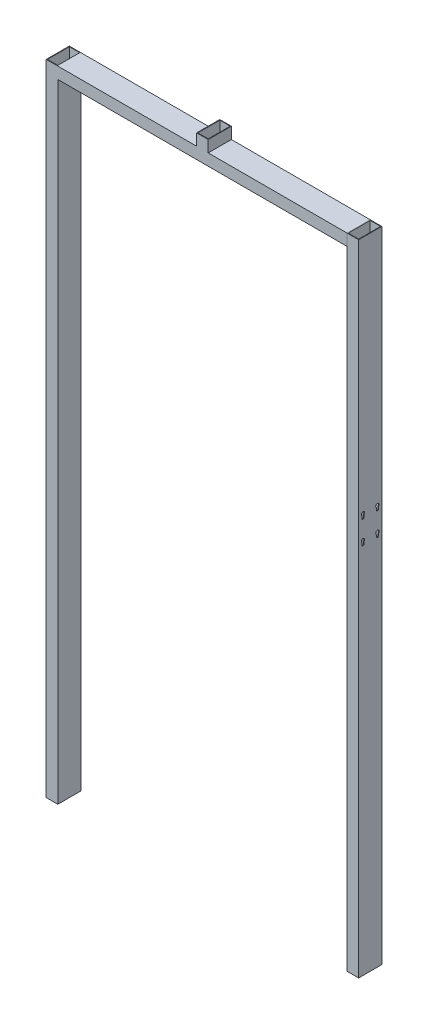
SolidWorks part; units mm, degrees
ref_plane "Plan de face" through (0, 0, 0) normal (0, 0, 1) x (1, 0, 0)
ref_plane "Plan de dessus" through (0, 0, 0) normal (0, 1, 0) x (1, 0, 0)
ref_plane "Plan de droite" through (0, 0, 0) normal (1, 0, 0) x (0, 0, -1)
sketch "Esquisse1" plane through (0, 0, 0) normal (0, 1, 0) x (1, 0, 0)
  line L0 (0, 59.5223) -> (0, -72.028) construction
  line L1 (500, 40) -> (500, -40)
  line L2 (-538, 38) -> (-538, -38)
  line L3 (-538, -38) -> (-502, -38)
  line L4 (-502, 38) -> (-502, -38)
  line L5 (-538, 38) -> (-502, 38)
  line L6 (540, -40) -> (500, -40)
  line L7 (540, 40) -> (540, -40)
  line L8 (540, 40) -> (500, 40)
  line L9 (538, 38) -> (502, 38)
  line L10 (502, 38) -> (502, -38)
  line L11 (538, -38) -> (502, -38)
  line L12 (538, 38) -> (538, -38)
  line L14 (-540, 40) -> (-500, 40)
  line L15 (-540, 40) -> (-540, -40)
  line L16 (-540, -40) -> (-500, -40)
  line L17 (-500, 40) -> (-500, -40)
  dimension "D2" = 40
  dimension "D3" = 2
  dimension "D4" = 40
  dimension "D9" = 80
  dimension "D12" = 500
extrude "Extrusion1" add sketch "Esquisse1" along normal blind 2210
sketch "Esquisse2" plane through (-500, 0, 0) normal (1, 0, 0) x (0, 0, -1)
  line L1 (-40, 2210) -> (40, 2210)
  line L2 (-40, 2210) -> (-40, 2170)
  line L3 (-40, 2170) -> (40, 2170)
  line L4 (40, 2210) -> (40, 2170)
  line L6 (-38, 2208) -> (38, 2208)
  line L7 (-38, 2208) -> (-38, 2172)
  line L8 (-38, 2172) -> (38, 2172)
  line L9 (38, 2208) -> (38, 2172)
  dimension "D1" = 40
  dimension "D2" = 36
  dimension "D3" = 2
  dimension "D4" = 2
  dimension "D5" = 76
  dimension "D6" = 40
extrude "Extrusion2" add sketch "Esquisse2" along normal up to next
sketch "Esquisse3" plane through (0, 2210, 0) normal (0, 1, 0) x (1, 0, 0)
  line L0 (500, 40) -> (-540, 40) construction
  line L1 (-20, 40) -> (20, 40)
  line L2 (-20, 40) -> (-20, -40)
  line L3 (-20, -40) -> (20, -40)
  line L4 (20, 40) -> (20, -40)
  line L5 (-540, -40) -> (500, -40) construction
  line L6 (-18, 38) -> (18, 38)
  line L7 (18, 38) -> (18, -38)
  line L8 (-18, -38) -> (18, -38)
  line L9 (-18, 38) -> (-18, -38)
  dimension "D1" = 40
  dimension "D2" = 20
  dimension "D3" = 2
extrude "Extrusion3" add sketch "Esquisse3" along normal blind 40
sketch "Esquisse7" plane through (-540, 0, 0) normal (-1, 0, 0) x (0, 0, 1)
  line L0 (-40, 2210) -> (-40, 0) construction
  line L1 (-21, 1370) -> (-21, 1377.5279)
  line L2 (-29, 1370) -> (-29, 1377.5279)
  line L3 (40, 2170) -> (-40, 2170) construction
  line L4 (21, 1370) -> (21, 1377.5279)
  line L5 (29, 1370) -> (29, 1377.5279)
  line L6 (-29, 1290) -> (-29, 1297.5279)
  line L7 (-21, 1290) -> (-21, 1297.5279)
  line L8 (21, 1290) -> (21, 1297.5279)
  line L9 (29, 1290) -> (29, 1297.5279)
  arc A0 (-21, 1377.5279) -> (-29, 1377.5279) centre (-25, 1382) ccw
  arc A1 (-29, 1370) -> (-21, 1370) centre (-25, 1370) ccw
  arc A2 (29, 1377.5279) -> (21, 1377.5279) centre (25, 1382) ccw
  arc A3 (21, 1370) -> (29, 1370) centre (25, 1370) ccw
  arc A4 (-21, 1297.5279) -> (-29, 1297.5279) centre (-25, 1302) ccw
  arc A5 (-29, 1290) -> (-21, 1290) centre (-25, 1290) ccw
  arc A6 (29, 1297.5279) -> (21, 1297.5279) centre (25, 1302) ccw
  arc A7 (21, 1290) -> (29, 1290) centre (25, 1290) ccw
  dimension "D2" = 15
  dimension "D3" = 12
  dimension "D4" = 8
  dimension "D5" = 12
  dimension "D6" = 800
  dimension "D1" = 15
extrude "Extrusion9" cut sketch "Esquisse7" against normal blind 5
mirror "Symétrie1" about plane through (0, 0, 0) normal (1, 0, 0) of "Extrusion9"
